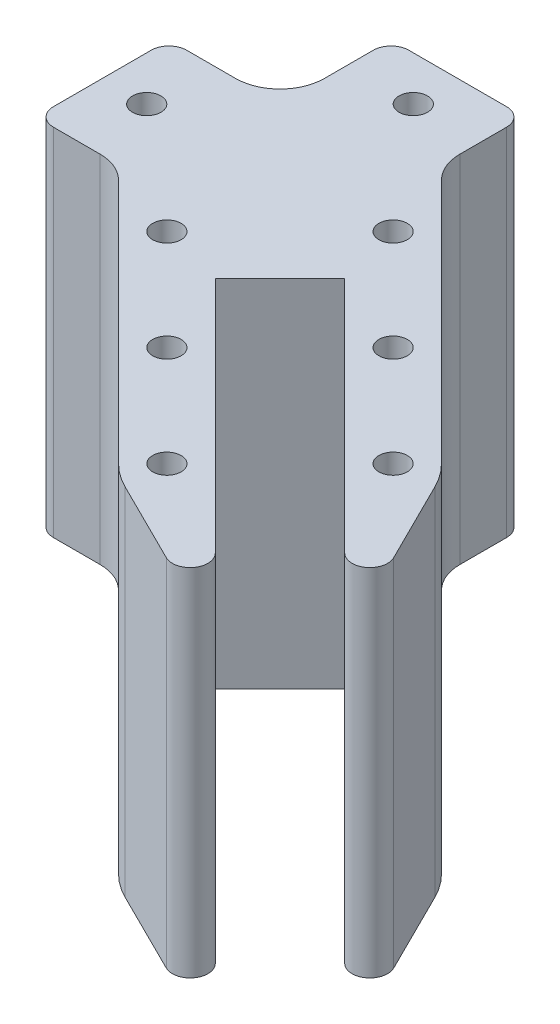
SolidWorks part; units mm, degrees
ref_plane "前视基准面" through (0, 0, 0) normal (0, 0, 1) x (1, 0, 0)
ref_plane "上视基准面" through (0, 0, 0) normal (0, 1, 0) x (1, 0, 0)
ref_plane "右视基准面" through (0, 0, 0) normal (1, 0, 0) x (0, 0, -1)
other "Configuration Table"
sketch "草图1" plane through (0, 0, 0) normal (0, 1, 0) x (1, 0, 0)
  line L0 (458.5965, -465.6676) -> (465.6676, -458.5965) construction
  line L1 (0, 0) -> (250, 0) construction
  line L2 (0, 0) -> (0, -250) construction
  line L3 (0, -250) -> (250, -250) construction
  line L4 (250, 0) -> (250, -250) construction
  line L5 (458.5965, -465.6676) -> (34.3324, -41.4035) construction
  line L6 (465.6676, -458.5965) -> (41.4035, -34.3324) construction
  line L7 (34.3324, -41.4035) -> (41.4035, -34.3324) construction
  line L8 (458.5965, -465.6676) -> (41.4035, -34.3324) construction
  line L9 (465.6676, -458.5965) -> (34.3324, -41.4035) construction
  line L10 (8, -43) -> (8, -13) construction
  line L11 (13, -8) -> (43, -8) construction
  line L12 (47.4774, -10.7746) -> (76.7588, -69.6878) construction
  line L13 (76.7588, -69.6878) -> (69.6878, -76.7588) construction
  line L14 (69.6878, -76.7588) -> (10.7746, -47.4774) construction
  line L15 (49.1817, -61.9096) -> (37.868, -50.5959) construction
  line L16 (64.632, -46.4593) -> (35.5, -17.3274)
  line L17 (35.5, -17.3274) -> (35.5, -8)
  line L18 (35.5, -8) -> (20.5, -8)
  line L19 (20.5, -8) -> (20.5, -20.5)
  line L20 (20.5, -20.5) -> (8, -20.5)
  line L21 (8, -20.5) -> (8, -35.5)
  line L22 (8, -35.5) -> (17.3274, -35.5)
  line L23 (17.3274, -35.5) -> (46.4593, -64.632)
  line L24 (60.6164, -67.8996) -> (33.8728, -41.156)
  line L25 (33.8728, -41.156) -> (41.156, -33.8728)
  line L26 (41.156, -33.8728) -> (67.8996, -60.6164)
  line L27 (49.1817, -61.9096) -> (61.9096, -49.1817) construction
  line L28 (49.0806, -66.5165) -> (58.312, -71.1048)
  line L29 (71.1048, -58.312) -> (66.5165, -49.0806)
  arc A0 (43, -8) -> (47.4774, -10.7746) centre (43, -13) cw construction
  arc A1 (8, -43) -> (10.7746, -47.4774) centre (13, -43) ccw construction
  arc A2 (8, -13) -> (13, -8) centre (13, -13) cw construction
  circle A3 centre (13, -13) radius 2.1 construction
  circle A4 centre (43, -13) radius 2.1 construction
  circle A5 centre (28, -13) radius 1.6
  circle A6 centre (13, -43) radius 2.1 construction
  circle A7 centre (13, -28) radius 1.6
  circle A8 centre (41.4035, -41.4035) radius 2.1 construction
  circle A9 centre (55.5456, -55.5456) radius 2.1 construction
  circle A10 centre (69.6878, -69.6878) radius 2.1 construction
  circle A11 centre (49.1817, -61.9096) radius 1.6
  circle A12 centre (37.868, -50.5959) radius 1.6
  circle A13 centre (26.5543, -39.2822) radius 1.6
  circle A14 centre (50.5959, -37.868) radius 1.6
  circle A15 centre (39.2822, -26.5543) radius 1.6
  circle A16 centre (61.9096, -49.1817) radius 1.6
  arc A19 (60.6164, -67.8996) -> (58.312, -71.1048) centre (59.2022, -69.3138) cw
  arc A20 (67.8996, -60.6164) -> (71.1048, -58.312) centre (69.3138, -59.2022) ccw
  arc A23 (46.4593, -64.632) -> (49.0806, -66.5165) centre (53.5332, -57.5581) ccw
  arc A24 (64.632, -46.4593) -> (66.5165, -49.0806) centre (57.5581, -53.5332) cw
  point P30 (46.0984, -8)
  point P33 (8, -46.0984)
  point P36 (8, -8)
  dimension "D11" = 5
  dimension "D12" = 4.2
  dimension "D16" = 4.2
  dimension "D26" = 3.2
  dimension "D36" = 2
  dimension "D37" = 2
  dimension "D1" = 250
  dimension "D2" = 250
  dimension "D3" = 10
  dimension "D4" = 45
  dimension "D5" = 600
  dimension "D6" = 8
  dimension "D7" = 8
  dimension "D8" = 30
  dimension "D9" = 30
  dimension "D10" = 50
  dimension "D13" = 15
  dimension "D14" = 15
  dimension "D15" = 3
  dimension "D17" = 5
  dimension "D18" = 5
  dimension "D19" = 20
  dimension "D22" = 16
  dimension "D23" = 25
  dimension "D24" = 4
  dimension "D25" = 4
  dimension "D27" = 25
  dimension "D28" = 0.15
  dimension "D29" = 0.15
  dimension "D30" = 7.5
  dimension "D31" = 7.5
  dimension "D32" = 7.5
  dimension "D33" = 0.5
  dimension "D34" = 3.85
  dimension "D35" = 3.85
  dimension "D20" = 3
  dimension "D21" = 2
extrude "凸台-拉伸1" add sketch "草图1" along normal blind 40
fillet "圆角2" radius 5 3 edges at (35.5, 20, 17.3274) (20.5, 20, 20.5) (17.3274, 20, 35.5)
fillet "圆角3" radius 2 4 edges at (35.5, 20, 8) (20.5, 20, 8) (8, 20, 35.5) (8, 20, 20.5)
